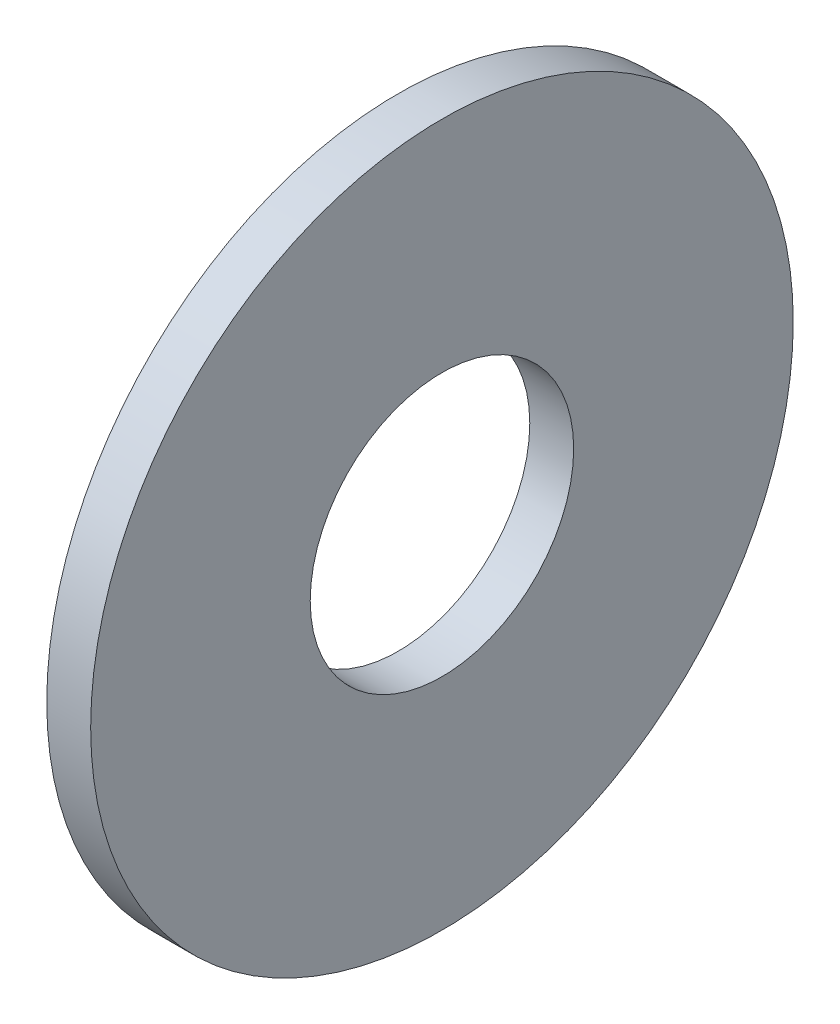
SolidWorks part; units mm, degrees
ref_plane "Plane1" through (0, 0, 0) normal (0, 0, 1) x (1, 0, 0)
ref_plane "Plane2" through (0, 0, 0) normal (0, 1, 0) x (1, 0, 0)
ref_plane "Plane3" through (0, 0, 0) normal (1, 0, 0) x (0, 0, -1)
sketch "Sketch1" plane through (0, 0, 0) normal (1, 0, 0) x (0, 0, -1)
  circle A0 centre (0, 0) radius 1.5
  circle A1 centre (0, 0) radius 4
  dimension "Insid_dia" = 3
  dimension "OutsideDia" = 8
extrude "Base-Extrude" add sketch "Sketch1" along normal blind 0.5
